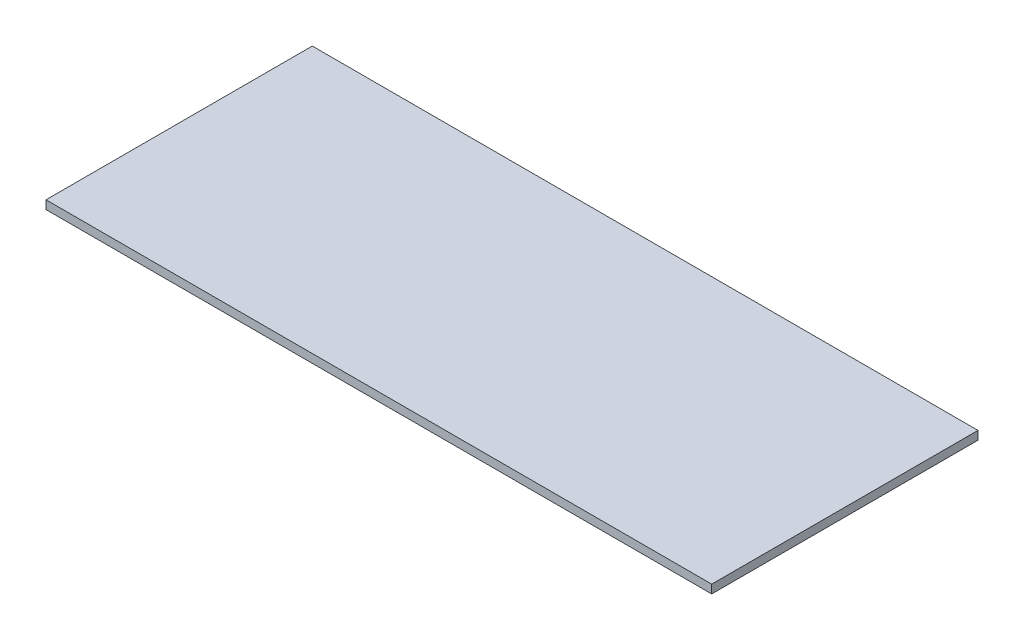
SolidWorks part; units mm, degrees
ref_plane "Front Plane" through (0, 0, 0) normal (0, 0, 1) x (1, 0, 0)
ref_plane "Top Plane" through (0, 0, 0) normal (0, 1, 0) x (1, 0, 0)
ref_plane "Right Plane" through (0, 0, 0) normal (1, 0, 0) x (0, 0, -1)
sketch "Sketch1" plane through (0, 0, 0) normal (0, 1, 0) x (1, 0, 0)
  line L1 (0, 0) -> (63.5, 0)
  line L2 (0, 0) -> (0, 25.4)
  line L3 (0, 25.4) -> (63.5, 25.4)
  line L4 (63.5, 0) -> (63.5, 25.4)
  dimension "D1" = 25.4
  dimension "D2" = 63.5
extrude "Boss-Extrude1" add sketch "Sketch1" along normal blind 0.8128
